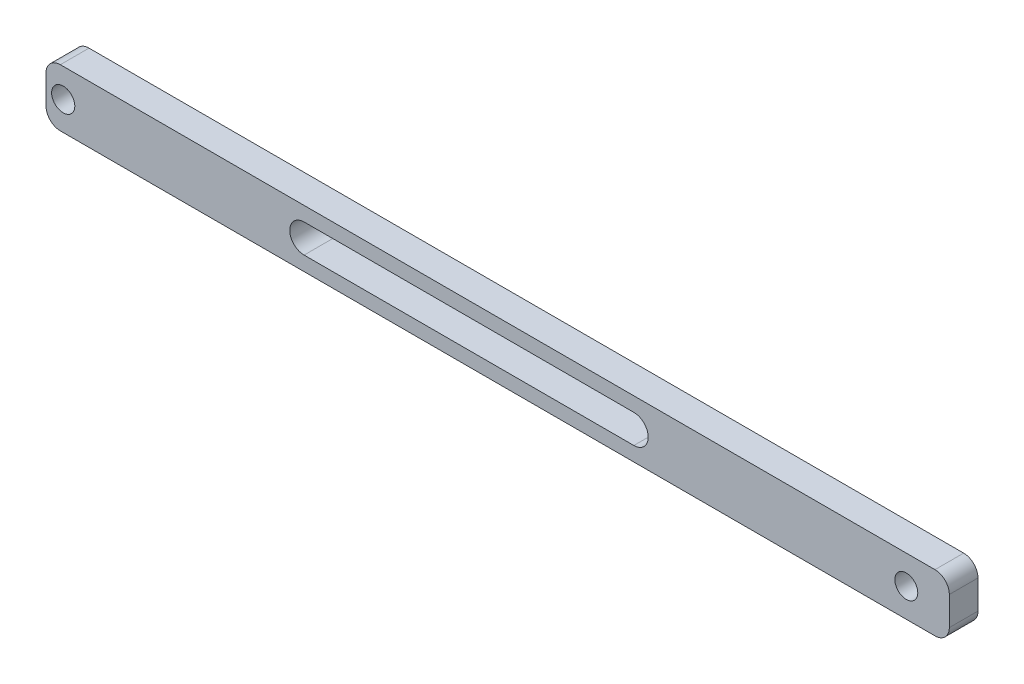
SolidWorks part; units mm, degrees
ref_plane "Frontal" through (0, 0, 0) normal (0, 0, 1) x (1, 0, 0)
ref_plane "Superior" through (0, 0, 0) normal (0, 1, 0) x (1, 0, 0)
ref_plane "Derecha" through (0, 0, 0) normal (1, 0, 0) x (0, 0, -1)
sketch "Croquis1" plane through (0, 0, 0) normal (0, 0, 1) x (1, 0, 0)
  line L1 (-125, 10) -> (180, 10)
  line L2 (-130, 5) -> (-130, -5)
  line L3 (-125, -10) -> (180, -10)
  line L4 (185, 5) -> (185, -5)
  arc A0 (185, 5) -> (180, 10) centre (180, 5) ccw
  arc A1 (180, -10) -> (185, -5) centre (180, -5) ccw
  arc A2 (-130, -5) -> (-125, -10) centre (-125, -5) ccw
  arc A3 (-125, 10) -> (-130, 5) centre (-125, 5) ccw
  point P9 (185, -10)
  point P12 (-130, -10)
  dimension "D5" = 5
  dimension "D6" = 5
  dimension "D1" = 315
  dimension "D2" = 10
  dimension "D3" = 10
  dimension "D4" = 130
extrude "Extruir1" add sketch "Croquis1" along normal blind 10
sketch "Croquis2" plane through (0, 0, 10) normal (0, 0, 1) x (1, 0, 0)
  line L0 (-40, 5) -> (75, 5)
  line L2 (-40, -5) -> (75, -5)
  circle A1 centre (170, 0) radius 4
  arc A2 (75, -5) -> (75, 5) centre (75, 0) ccw
  arc A3 (-40, 5) -> (-40, -5) centre (-40, 0) ccw
  dimension "D1" = 8
  dimension "D2" = 75
  dimension "D3" = 10
  dimension "D4" = 10
  dimension "D5" = 40
  dimension "D6" = 95
extrude "Cortar-Extruir1" cut sketch "Croquis2" against normal blind 10
sketch "Croquis3" plane through (0, 0, 10) normal (0, 0, 1) x (1, 0, 0)
  circle A0 centre (-124, 0) radius 4.0436
  dimension "D1" = 124
extrude "Cortar-Extruir2" cut sketch "Croquis3" against normal blind 10
